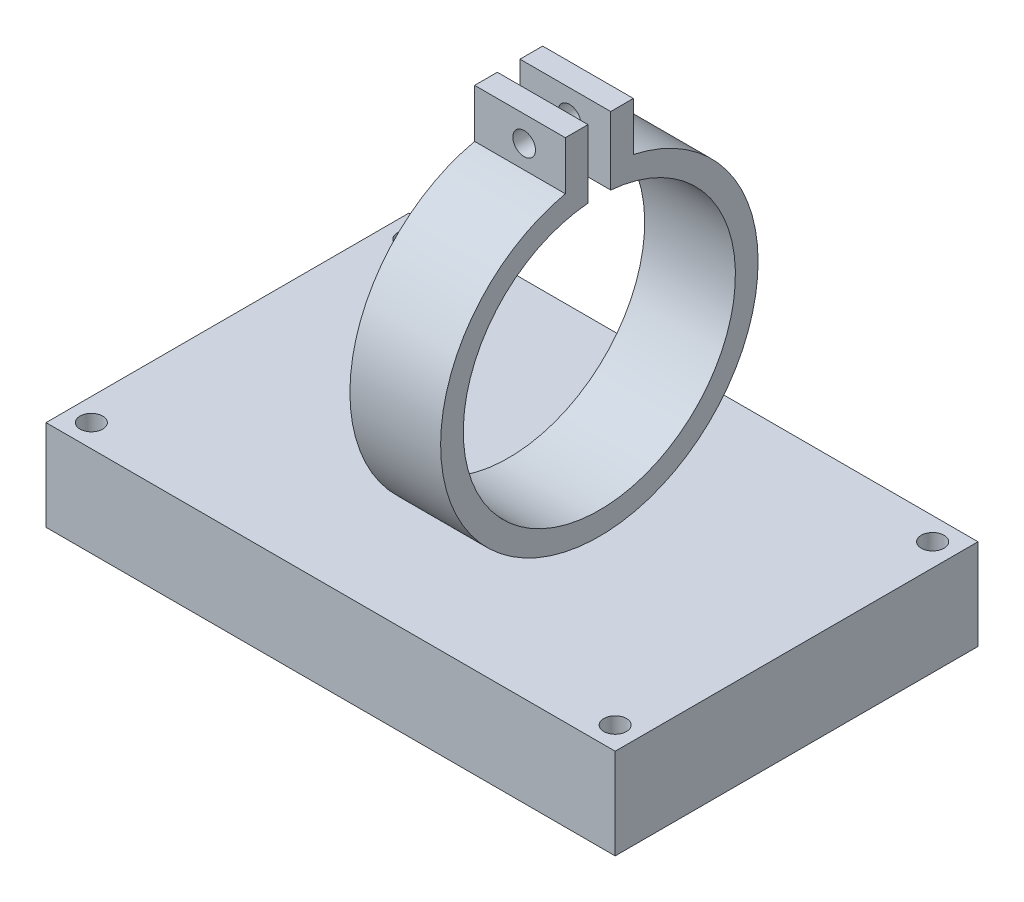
SolidWorks part; units mm, degrees
ref_plane "Front Plane" through (0, 0, 0) normal (0, 0, 1) x (1, 0, 0)
ref_plane "Top Plane" through (0, 0, 0) normal (0, 1, 0) x (1, 0, 0)
ref_plane "Right Plane" through (0, 0, 0) normal (1, 0, 0) x (0, 0, -1)
sketch "Sketch1" plane through (0, 0, 0) normal (0, 1, 0) x (1, 0, 0)
  line L1 (-62.75, -40) -> (62.75, -40)
  line L2 (-62.75, -40) -> (-62.75, 40)
  line L3 (-62.75, 40) -> (62.75, 40)
  line L4 (62.75, -40) -> (62.75, 40)
  line L5 (-62.75, -40) -> (62.75, 40) construction
  line L6 (-62.75, 40) -> (62.75, -40) construction
  circle A0 centre (-57.75, 35) radius 2.5
  circle A1 centre (-57.75, -35) radius 2.5
  circle A2 centre (57.75, 35) radius 2.5
  circle A3 centre (57.75, -35) radius 2.5
  point P0 (0, 0)
  dimension "D3" = 5
  dimension "D5" = 5
  dimension "D6" = 5
  dimension "D9" = 5
  dimension "D12" = 5
  dimension "D15" = 5
  dimension "D1" = 80
  dimension "D2" = 125.5
  dimension "D4" = 5
  dimension "D7" = 5
  dimension "D8" = 5
  dimension "D10" = 5
  dimension "D11" = 5
  dimension "D13" = 5
  dimension "D14" = 5
extrude "Boss-Extrude1" add sketch "Sketch1" along normal blind 20
sketch "Sketch2" plane through (0, 0, 0) normal (1, 0, 0) x (0, 0, -1)
  line L0 (-16.1942, 20) -> (14.7022, 20) construction
  line L1 (-40, 20) -> (40, 20) construction
  line L4 (-3.238, 84.8957) -> (-3.238, 89.9106)
  line L6 (1.762, 84.8957) -> (1.762, 89.9106)
  arc A0 (-3.238, 84.8957) -> (1.762, 84.8957) centre (-0.738, 55) ccw
  arc A1 (-3.238, 89.9106) -> (1.762, 89.9106) centre (-0.738, 55) ccw
  point P8 (-0.738, 80.7136)
  dimension "D1" = 60
  dimension "D2" = 70
extrude "Boss-Extrude2" add sketch "Sketch2" along normal blind 20 separate body
sketch "Sketch3" plane through (20, 0, 0) normal (1, 0, 0) x (0, 0, -1)
  line L1 (1.762, 84.8957) -> (6.762, 84.8957)
  line L2 (1.762, 84.8957) -> (1.762, 99.8957)
  line L3 (1.762, 99.8957) -> (6.762, 99.8957)
  line L4 (6.762, 84.8957) -> (6.762, 99.8957)
  line L5 (-3.238, 84.8957) -> (-8.238, 84.8957)
  line L6 (-3.238, 84.8957) -> (-3.238, 99.8957)
  line L7 (-3.238, 99.8957) -> (-8.238, 99.8957)
  line L8 (-8.238, 84.8957) -> (-8.238, 99.8957)
  dimension "D1" = 5
  dimension "D2" = 5
  dimension "D3" = 15
  dimension "D4" = 15
extrude "Boss-Extrude3" add sketch "Sketch3" against normal blind 20
sketch "Sketch4" plane through (0, 0, 8.238) normal (0, 0, 1) x (1, 0, 0)
  circle A0 centre (10.9198, 94.233) radius 2.5
  dimension "D1" = 5
extrude "Cut-Extrude1" cut sketch "Sketch4" against normal blind 100
